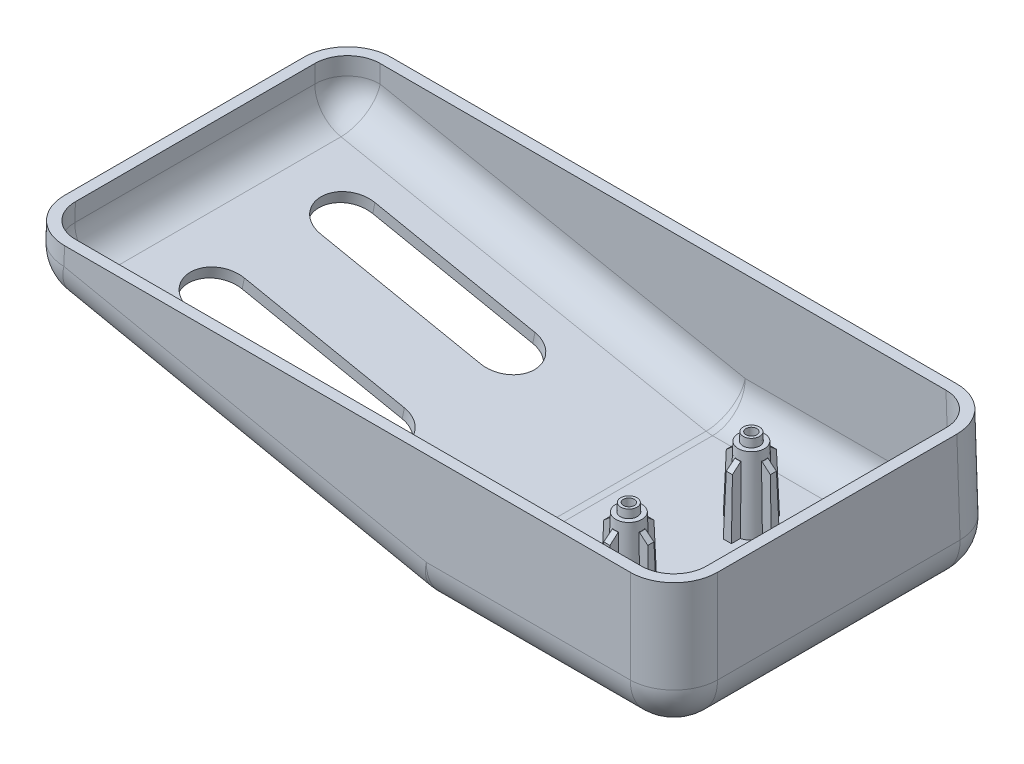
SolidWorks part; units mm, degrees
ref_plane "Front Plane" through (0, 0, 0) normal (0, 0, 1) x (1, 0, 0)
ref_plane "Top Plane" through (0, 0, 0) normal (0, 1, 0) x (1, 0, 0)
ref_plane "Right Plane" through (0, 0, 0) normal (1, 0, 0) x (0, 0, -1)
sketch "Sketch1" plane through (0, 0, 0) normal (0, 0, 1) x (1, 0, 0)
  line L0 (-60, 0) -> (60, 0)
  line L1 (60, 0) -> (60, -25)
  line L2 (60, -25) -> (14, -25)
  line L3 (14, -25) -> (-60, -10)
  line L4 (-60, -10) -> (-60, 0)
  point P6 (0, 0)
  dimension "D1" = 120
  dimension "D2" = 25
  dimension "D3" = 10
  dimension "D4" = 46
extrude "Boss-Extrude1" add sketch "Sketch1" along normal mid plane 60
draft "Draft1" type of draft neutral plane draft angle 1 faces to draft 4 parameters "D1"=1
fillet "Fillet1" radius 8 11 edges at (-23.087, -17.4824, 30.3052) (-60.1739, -9.9647, 0) (-23.087, -17.4824, -30.3052) (14, -25, 0) (60.4364, -25, 0) (37.2182, -25, 30.4364) (37.2182, -25, -30.4364) (60.2182, -12.5, 30.2182) (-60.087, -4.9824, 30.087) (-60.087, -4.9824, -30.087) (60.2182, -12.5, -30.2182)
shell "Shell1" thickness 2
sketch "Sketch2" plane through (-4.315, -21.2875, 0) normal (-0.1987, -0.9801, 0) x (0.9801, -0.1987, 0)
  line L0 (-38.8041, 12) -> (-8.8041, 12) construction
  line L1 (-38.8041, 17) -> (-8.8041, 17)
  line L2 (-38.8041, 7) -> (-8.8041, 7)
  line L3 (-38.8041, -12) -> (-8.8041, -12) construction
  line L4 (-38.8041, -7) -> (-8.8041, -7)
  line L5 (-38.8041, -17) -> (-8.8041, -17)
  line L6 (-58.8041, 22.0012) -> (-58.8041, -22.0012) construction
  line L8 (50.9647, -30) -> (-50.9647, -30) construction
  arc A0 (-38.8041, 17) -> (-38.8041, 7) centre (-38.8041, 12) ccw
  arc A1 (-8.8041, 7) -> (-8.8041, 17) centre (-8.8041, 12) ccw
  arc A2 (-38.8041, -7) -> (-38.8041, -17) centre (-38.8041, -12) ccw
  arc A3 (-8.8041, -17) -> (-8.8041, -7) centre (-8.8041, -12) ccw
  point P2 (-23.8041, 12)
  point P7 (-23.8041, -12)
  dimension "D3" = 10
  dimension "D1" = 30
  dimension "D2" = 20
  dimension "D4" = 18
  dimension "D5" = 24
extrude "Cut-Extrude1" cut sketch "Sketch2" against normal up to next
sketch3d "3DSketch1"
  line L0 (60.2943, -16.8604, 22.2955) -> (60.2943, -16.8604, -22.2955) construction
  line L1 (52.2955, -16.8604, -30.2943) -> (14.8026, -16.8604, -30.2943) construction
  point P0 (32.9757, -23, -11.26)
  dimension "D1" = 28
  dimension "D2" = 20
other "Mounting Boss1" parameters "BossHeight"=14, "BossDiam"=4.8, "StepHeight"=1.5, "StepDia"=3, "HoleDiam"=2, "CBoreDiam"=2.5, "CBoreDepth"=5, "D8"=0, "D9"=0, "D10"=0, "Clearance"=0.254, "FinLength"=4, "FinWidth"=1.5, "FinHeight"=12, "ChamferDist"=1.5, "BossDraft"=2, "HoleDraft"=1, "StepDraft"=0, "D19"=0, "FinDraft"=1, "ChamferAngle"=40
mirror "Mirror3" about plane through (0, 0, 0) normal (0, 0, 1) of "Mounting Boss1"
